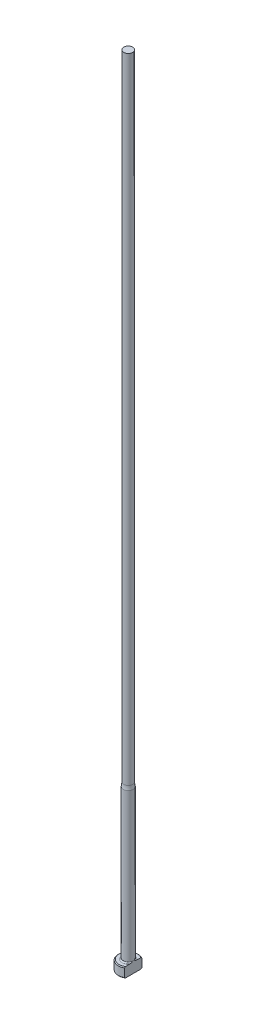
SolidWorks part; units mm, degrees
ref_plane "Front Plane" through (0, 0, 0) normal (0, 0, 1) x (1, 0, 0)
ref_plane "Top Plane" through (0, 0, 0) normal (0, 1, 0) x (1, 0, 0)
ref_plane "Right Plane" through (0, 0, 0) normal (1, 0, 0) x (0, 0, -1)
sketch "Sketch1" plane through (0, 0, 0) normal (0, 0, 1) x (1, 0, 0)
  line L0 (0, 259.9588) -> (0, -15.1925) construction
  line L1 (0, 0) -> (-3.175, 0)
  line L2 (-3.175, 0) -> (-3.175, 3.175)
  line L3 (-3.175, 3.175) -> (-1.5875, 3.175)
  line L4 (-1.4516, 52.1067) -> (-1.4516, 254)
  line L5 (-1.4516, 254) -> (0, 254)
  line L6 (0, 254) -> (0, 0)
  line L7 (-1.5875, 3.175) -> (-1.5875, 50.8)
  arc A0 (-1.5875, 50.8) -> (-1.4516, 52.1067) centre (-7.8016, 52.1067) ccw
  point P13 (-1.5875, 0)
  dimension "D1" = 6.35
  dimension "L" = 254
  dimension "D2" = 3.175
  dimension "H" = 6.35
  dimension "T" = 3.175
  dimension "D" = 2.9032
  dimension "S" = 50.8
revolve "Revolve1" add sketch "Sketch1" angle 360 about L0
chamfer "Chamfer1" distance 0.254 angle 45 2 edges at (0, 3.175, 3.175) (0, 0, 3.175)
fillet "Fillet1" radius 0.381 1 edges at (0, 3.175, 1.5875)
sketch "Sketch2" plane through (0, 0, 0) normal (0, 1, 0) x (1, 0, 0)
  line L0 (1.5875, -2.7496) -> (1.5875, 2.7496)
  circle A0 centre (0, 0) radius 3.175 construction
  arc A2 (1.5875, -2.7496) -> (1.5875, 2.7496) centre (0, 0) ccw
  circle A3 centre (0, 0) radius 3.175 construction
  circle A4 centre (0, 0) radius 1.5875 construction
extrude "Key Head" cut sketch "Sketch2" along normal up to next
